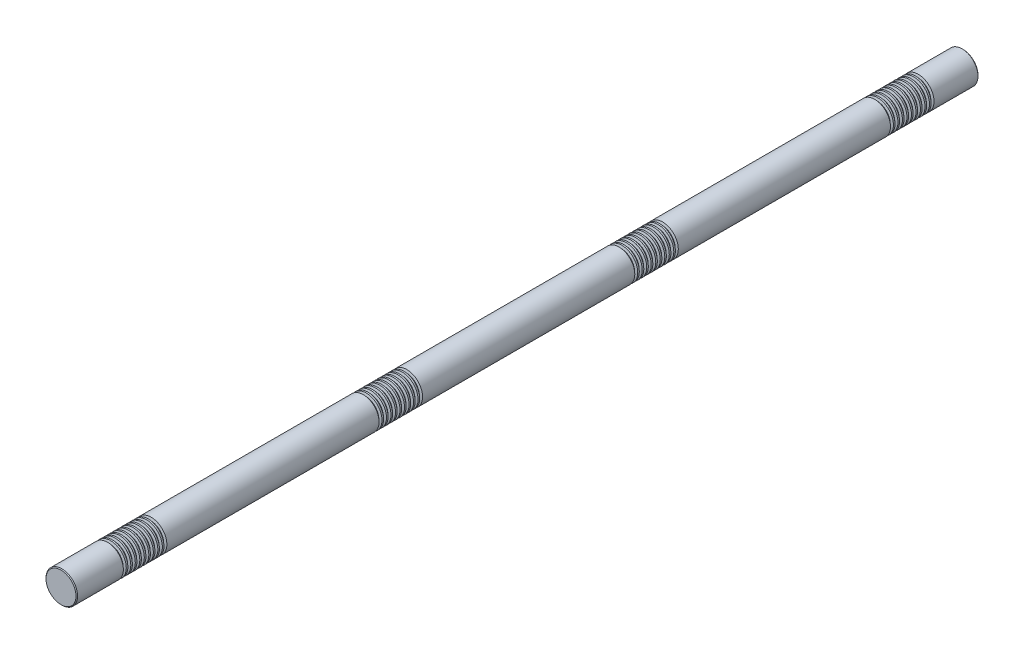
SolidWorks part; units mm, degrees
ref_plane "Front Plane" through (0, 0, 0) normal (0, 0, 1) x (1, 0, 0)
ref_plane "Top Plane" through (0, 0, 0) normal (0, 1, 0) x (1, 0, 0)
ref_plane "Right Plane" through (0, 0, 0) normal (1, 0, 0) x (0, 0, -1)
sketch "Sketch1" plane through (0, 0, 0) normal (0, 0, 1) x (1, 0, 0)
  circle A0 centre (0, 0) radius 35
  dimension "D1" = 70
extrude "Boss-Extrude1" add sketch "Sketch1" along normal mid plane 2000
chamfer "Chamfer1" distance 1.75 angle 45 2 edges at (35, 0, -1000) (35, 0, 1000)
sketch "Sketch2" plane through (0, 0, 0) normal (1, 0, 0) x (0, 0, -1)
  line L0 (900.7369, 35) -> (894.2631, 35)
  line L1 (998.25, 35) -> (-998.25, 35) construction
  line L2 (894.2631, 35) -> (895.7369, 29.5)
  line L3 (895.7369, 29.5) -> (899.2631, 29.5)
  line L4 (899.2631, 29.5) -> (900.7369, 35)
  line L5 (1000, -33.25) -> (1000, 33.25) construction
  point P4 (897.5, 35)
  point P7 (897.5, 29.5)
  point P8 (900, 32.25)
  point P9 (895, 32.25)
  dimension "D1" = 5
  dimension "D2" = 100
  dimension "D3" = 5.5
  dimension "D4" = 30
revolve "Cut-Revolve1" cut sketch "Sketch2" angle 360 about axis through (0, 0, 1000) along (0, 0, -1)
pattern_linear "LPattern1" count 10 spacing 10 along (0, 0, 1) of "Cut-Revolve1"
pattern_linear "LPattern2" count 4 spacing 567 along (0, 0, 1) of "Cut-Revolve1", "LPattern1"
